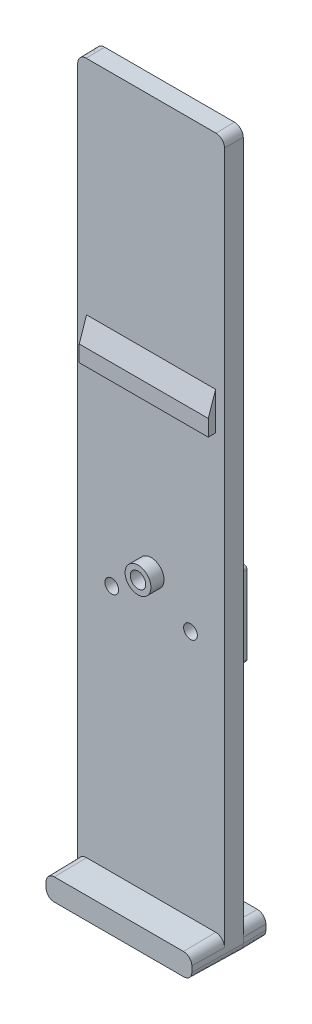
SolidWorks part; units mm, degrees
ref_plane "Front Plane" through (0, 0, 0) normal (0, 0, 1) x (1, 0, 0)
ref_plane "Top Plane" through (0, 0, 0) normal (0, 1, 0) x (1, 0, 0)
ref_plane "Right Plane" through (0, 0, 0) normal (1, 0, 0) x (0, 0, -1)
sketch "Sketch1" plane through (0, 0, 0) normal (0, 0, 1) x (1, 0, 0)
  line L1 (-11.176, -61.6585) -> (11.176, -61.6585)
  line L2 (-12.7, -60.1345) -> (-12.7, 60.1345)
  line L3 (-11.176, 61.6585) -> (11.176, 61.6585)
  line L4 (12.7, -60.1345) -> (12.7, 60.1345)
  line L5 (-12.7, -61.6585) -> (12.7, 61.6585) construction
  line L6 (-12.7, 61.6585) -> (12.7, -61.6585) construction
  arc A0 (-12.7, 60.1345) -> (-11.176, 61.6585) centre (-11.176, 60.1345) cw
  arc A1 (11.176, 61.6585) -> (12.7, 60.1345) centre (11.176, 60.1345) cw
  arc A2 (11.176, -61.6585) -> (12.7, -60.1345) centre (11.176, -60.1345) ccw
  arc A3 (-11.176, -61.6585) -> (-12.7, -60.1345) centre (-11.176, -60.1345) cw
  point P0 (0, 0)
  dimension "D3" = 1.524
  dimension "D1" = 25.4
  dimension "D2" = 123.317
extrude "Boss-Extrude1" add sketch "Sketch1" along normal blind 3.175 draft 1
sketch "Sketch2" plane through (0, 0, 0) normal (1, 0, 0) x (0, 0, -1)
  line L0 (-3.175, -60.1345) -> (-3.175, 60.1345) construction
  line L1 (-3.175, 16.8483) -> (-3.175, 23.3507)
  line L2 (-3.175, 16.8483) -> (-4.445, 16.8483)
  line L3 (-4.445, 16.8483) -> (-4.445, 19.6423)
  line L4 (-4.445, 19.6423) -> (-3.175, 23.3507)
  dimension "D1" = 1.27
  dimension "D2" = 2.794
  dimension "D3" = 6.5024
  dimension "D4" = 44.7548
extrude "Boss-Extrude2" add sketch "Sketch2" along normal mid plane 22.225
sketch "Sketch3" plane through (0, 0, 3.175) normal (0, 0, 1) x (1, 0, 0)
  line L0 (-11.176, -61.6031) -> (11.176, -61.6031) construction
  line L1 (-12.6446, 60.1345) -> (-12.6446, -60.1345) construction
  line L2 (12.6446, -60.1345) -> (12.6446, 60.1345) construction
  line L3 (-11.176, -61.6031) -> (11.176, -61.6031)
  line L4 (-12.6446, -59.1647) -> (-12.6446, -60.1345)
  line L5 (12.6446, -60.1345) -> (12.6446, -59.1647)
  line L6 (-11.1206, -57.6407) -> (11.1206, -57.6407)
  arc A0 (-12.6446, -60.1345) -> (-11.176, -61.6031) centre (-11.176, -60.1345) ccw construction
  arc A1 (11.176, -61.6031) -> (12.6446, -60.1345) centre (11.176, -60.1345) ccw construction
  arc A2 (-12.6446, -60.1345) -> (-11.176, -61.6031) centre (-11.176, -60.1345) ccw
  arc A3 (11.176, -61.6031) -> (12.6446, -60.1345) centre (11.176, -60.1345) ccw
  arc A4 (12.6446, -59.1647) -> (11.1206, -57.6407) centre (11.1206, -59.1647) ccw
  arc A5 (-12.6446, -59.1647) -> (-11.1206, -57.6407) centre (-11.1206, -59.1647) cw
  dimension "D2" = 1.524
  dimension "D1" = 3.9624
extrude "Boss-Extrude3" add sketch "Sketch3" along normal blind 5.5372 draft 1
sketch "Sketch4" plane through (0, 0, 0) normal (0, 0, -1) x (-1, 0, 0)
  line L0 (11.176, -61.6585) -> (-11.176, -61.6585) construction
  line L1 (-12.7, -60.1345) -> (-12.7, 60.1345) construction
  line L2 (12.7, 60.1345) -> (12.7, -60.1345) construction
  line L3 (11.176, -61.6585) -> (-11.176, -61.6585)
  line L4 (-12.7, -60.1345) -> (-12.7, -59.2201)
  line L5 (12.7, -59.2201) -> (12.7, -60.1345)
  line L6 (-11.176, -57.6961) -> (11.176, -57.6961)
  arc A0 (-12.7, -60.1345) -> (-11.176, -61.6585) centre (-11.176, -60.1345) ccw construction
  arc A1 (11.176, -61.6585) -> (12.7, -60.1345) centre (11.176, -60.1345) ccw construction
  arc A2 (-12.7, -60.1345) -> (-11.176, -61.6585) centre (-11.176, -60.1345) ccw
  arc A3 (11.176, -61.6585) -> (12.7, -60.1345) centre (11.176, -60.1345) ccw
  arc A4 (12.7, -59.2201) -> (11.176, -57.6961) centre (11.176, -59.2201) ccw
  arc A5 (-11.176, -57.6961) -> (-12.7, -59.2201) centre (-11.176, -59.2201) ccw
  dimension "D1" = 1.524
  dimension "D2" = 3.9624
extrude "Boss-Extrude4" add sketch "Sketch4" along normal blind 3.9624 draft 1
sketch "Sketch5" plane through (0, 0, 0) normal (0, 0, -1) x (-1, 0, 0)
  line L0 (0, 0) -> (0, -83.2761) construction
  line L1 (-11.176, 61.6585) -> (11.176, 61.6585) construction
  line L2 (-6.2611, -55.5371) -> (-10.2235, -55.5371)
  line L3 (-6.2611, -55.5371) -> (-6.2611, 59.2201)
  line L4 (-6.2611, 59.2201) -> (-10.2235, 59.2201)
  line L5 (-10.2235, -55.5371) -> (-10.2235, 59.2201)
  line L6 (11.176, -57.6961) -> (-11.176, -57.6961) construction
  line L7 (6.2611, -55.5371) -> (10.2235, -55.5371)
  line L8 (6.2611, 59.2201) -> (10.2235, 59.2201)
  line L9 (6.2611, -55.5371) -> (6.2611, 59.2201)
  line L10 (10.2235, -55.5371) -> (10.2235, 59.2201)
  dimension "D1" = 3.9624
  dimension "D2" = 2.4384
  dimension "D3" = 2.159
  dimension "D4" = 12.5222
extrude "Cut-Extrude1" cut sketch "Sketch5" against normal blind 0.9398 draft 1
sketch "Sketch6" plane through (0, 0, 0) normal (0, 0, -1) x (-1, 0, 0)
  line L0 (0, 0) -> (0, -25.9955) construction
  line L1 (6.1352, -6.6167) -> (10.2362, -6.6167)
  line L2 (-10.2362, -21.1201) -> (10.2362, -21.1201)
  line L3 (-10.2362, -21.1201) -> (-10.2362, -6.6167)
  line L4 (-10.2362, -6.6167) -> (-6.1352, -6.6167)
  line L5 (10.2362, -21.1201) -> (10.2362, -6.6167)
  line L6 (-10.2362, -21.1201) -> (10.2362, -6.6167) construction
  line L7 (-10.2362, -6.6167) -> (10.2362, -21.1201) construction
  line L8 (11.176, -57.6961) -> (-11.176, -57.6961) construction
  arc A0 (-6.1352, -6.6167) -> (6.1352, -6.6167) centre (0, -7.1628) ccw
  point P3 (0, -13.8684)
  dimension "D3" = 6.1595
  dimension "D5" = 7.7978
  dimension "D1" = 20.4724
  dimension "D2" = 14.5034
  dimension "D4" = 36.576
extrude "Boss-Extrude5" add sketch "Sketch6" along normal blind 3.175 draft 1 and the other way blind 1.524 draft 1
sketch "Sketch7" plane through (0, 0, -3.175) normal (0, 0, -1) x (-1, 0, 0)
  line L0 (0, 0) -> (0, -30.4365) construction
  line L1 (-25.0897, -14.9479) -> (27.4106, -14.9479) construction
  line L2 (11.176, -57.6961) -> (-11.176, -57.6961) construction
  circle A0 centre (-6.7818, -14.9479) radius 1.1811
  circle A1 centre (6.7818, -14.9479) radius 1.1811
  dimension "D1" = 2.3622
  dimension "D2" = 6.7818
  dimension "D3" = 42.7482
extrude "Cut-Extrude2" cut sketch "Sketch7" against normal through all
fillet "Fillet1" radius 0.508 6 edges at (10.2085, -21.0924, -1.5875) (-10.2085, -21.0924, -1.5875) (10.2085, -6.6444, -1.5875) (-10.2085, -6.6444, -1.5875)
sketch "Sketch8" plane through (0, 0, 3.175) normal (0, 0, 1) x (1, 0, 0)
  line L0 (0, 0) -> (0, -36.6217) construction
  circle A0 centre (0, -9.5161) radius 2.2225
  dimension "D1" = 4.445
extrude "Boss-Extrude6" add sketch "Sketch8" along normal blind 2.2606
sketch "Sketch9" plane through (0, 0, 5.4356) normal (0, 0, 1) x (1, 0, 0)
  circle A0 centre (0, -9.5161) radius 1.3335
  dimension "D1" = 2.667
extrude "Cut-Extrude3" cut sketch "Sketch9" against normal through all
